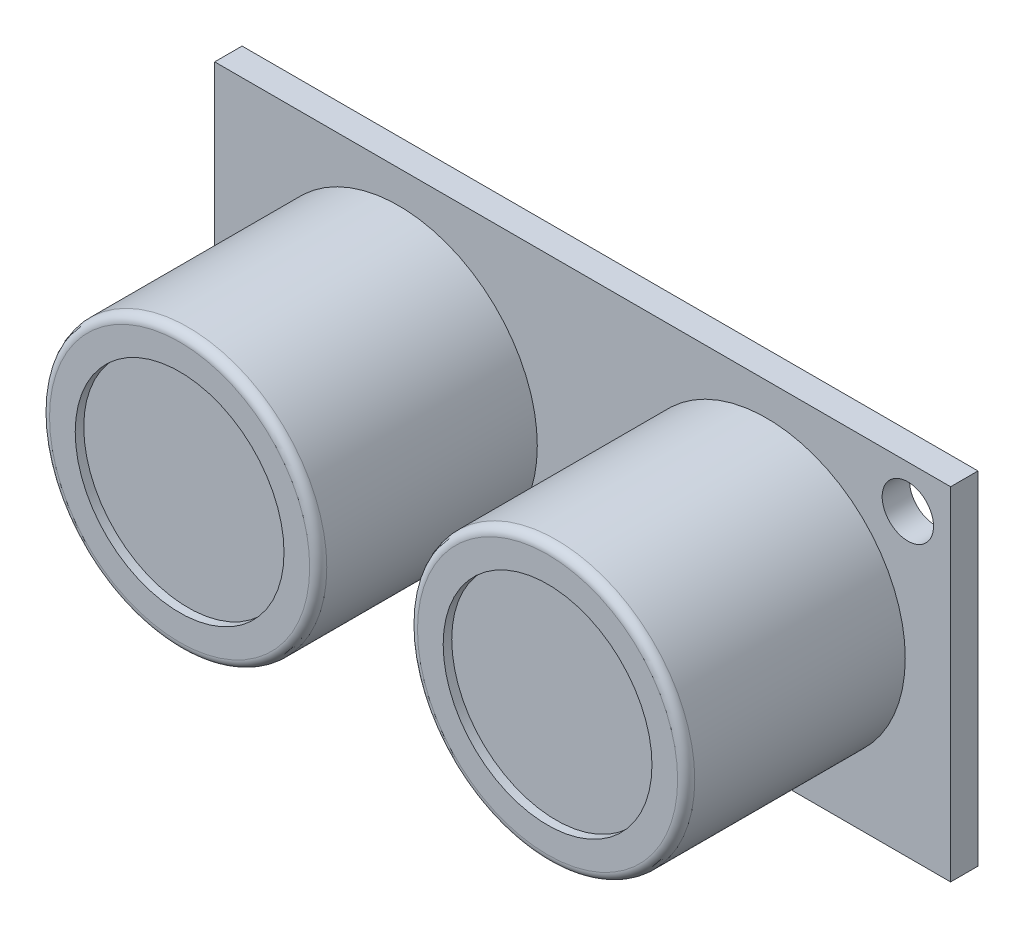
SolidWorks part; units mm, degrees
ref_plane "Plan de face" through (0, 0, 0) normal (0, 0, 1) x (1, 0, 0)
ref_plane "Plan de dessus" through (0, 0, 0) normal (0, 1, 0) x (1, 0, 0)
ref_plane "Plan de droite" through (0, 0, 0) normal (1, 0, 0) x (0, 0, -1)
sketch "Esquisse1" plane through (0, 0, 0) normal (0, 0, 1) x (1, 0, 0)
  line L0 (21.5, 27.1461) -> (21.5, -5.7816) construction
  line L1 (0, 0) -> (43, 0)
  line L2 (0, 0) -> (0, 20)
  line L3 (0, 20) -> (43, 20)
  line L4 (43, 0) -> (43, 20)
  line L5 (55.0733, 0) -> (-1.9588, 0) construction
  line L6 (55.0733, 10) -> (24.8466, 10) construction
  line L7 (0, -5.7816) -> (0, 25.8466) construction
  line L8 (2.5, -5.7816) -> (2.5, 3.5984) construction
  line L9 (-1.9588, 2.5) -> (6.2168, 2.5) construction
  line L10 (32.25, -5.7816) -> (32.25, 12.1194) construction
  line L11 (44.9003, 1.3) -> (12.1151, 1.3) construction
  circle A0 centre (2.5, 2.5) radius 1.5
  circle A2 centre (40.5, 17.5) radius 1.5
  dimension "D5" = 10.75
  dimension "D6" = 1.3
  dimension "D1" = 21.5
  dimension "D2" = 10
  dimension "D3" = 2.5
  dimension "D4" = 2.5
extrude "Extrusion1" add sketch "Esquisse1" along normal blind 1.6
sketch "Esquisse2" plane through (0, 0, 1.6) normal (0, 0, 1) x (1, 0, 0)
  line L0 (45.5442, 10) -> (26.9424, 10) construction
  line L1 (32.25, 21.9612) -> (32.25, 8.0302) construction
  line L2 (0, 0) -> (43, 0) construction
  line L3 (43, 0) -> (43, 20) construction
  circle A0 centre (32.25, 10) radius 8.1
  dimension "D1" = 10
  dimension "D2" = 10.75
extrude "Extrusion2" add sketch "Esquisse2" along normal blind 12.8
sketch "Esquisse3" plane through (0, 0, 14.4) normal (0, 0, 1) x (1, 0, 0)
  circle A0 centre (32.25, 10) radius 6.1
extrude "Enlèv. mat.-Extru.1" cut sketch "Esquisse3" against normal blind 0.5
fillet "Congé1" radius 0.5 1 edges at (40.35, 10, 14.4)
ref_plane "Plan1" through (21.5, 0, 0) normal (1, 0, 0) x (0, 0, -1)
mirror "Symétrie1" about plane through (21.5, 0, 0) normal (1, 0, 0) of "Extrusion2", "Enlèv. mat.-Extru.1", "Congé1"
sketch "Esquisse4" plane through (0, 0, 0) normal (0, 0, -1) x (-1, 0, 0)
  line L0 (-45.2192, 2.5) -> (-11.6626, 2.5) construction
  line L1 (0, 0) -> (-43, 0) construction
  line L2 (0, -2.8433) -> (0, 21.6045) construction
  line L3 (-21.5, -1.2402) -> (-21.5, 21.6045) construction
  line L4 (2.0734, 0) -> (-34.2887, 0) construction
  line L5 (-27.9, -4.9565) -> (-27.9, 5.4274) construction
  line L6 (-15.1, -4.9565) -> (-15.1, 5.4274) construction
  line L8 (-27.9, 2.5) -> (-15.1, 2.5)
  line L9 (-27.9, 2.5) -> (-27.9, 0)
  line L10 (-27.9, 0) -> (-15.1, 0)
  line L11 (-15.1, 2.5) -> (-15.1, 0)
  dimension "D1" = 2.5
  dimension "D2" = 21.5
  dimension "D3" = 6.4
  dimension "D4" = 12.8
extrude "Extrusion3" add sketch "Esquisse4" along normal blind 2.5
sketch "Esquisse6" plane through (0, 0, -2.5) normal (0, 0, -1) x (-1, 0, 0)
  line L0 (-21.5, -2.5883) -> (-21.5, 3.1684) construction
  line L1 (-13.4479, 1.25) -> (-36.4019, 1.25) construction
  circle A0 centre (-21.5, 1.25) radius 0.3
  circle A1 centre (-18.96, 1.25) radius 0.3
  circle A2 centre (-16.42, 1.25) radius 0.3
  circle A3 centre (-26.58, 1.25) radius 0.3
  circle A4 centre (-24.04, 1.25) radius 0.3
sketch "Esquisse7" plane through (21.5, 0, 0) normal (1, 0, 0) x (0, 0, -1)
  line L0 (2.5, 1.25) -> (15.0225, 1.25) construction
  line L1 (-4.6, 0) -> (18.2471, 0) construction
  line L2 (5.5, 5.3638) -> (5.5, -9.1362) construction
  line L3 (2.5, -9.1362) -> (2.5, 5.3638) construction
  line L4 (-4.6, -2) -> (15.0225, -2) construction
  line L5 (2.5, 1.25) -> (5, 1.25)
  line L6 (5.5, 0.75) -> (5.5, -2)
  arc A0 (5, 1.25) -> (5.5, 0.75) centre (5, 0.75) cw
  dimension "D3" = 0.5
  dimension "D1" = 3
  dimension "D2" = 2
sweep "Balayage1" add profiles "Esquisse6" path "Esquisse7"
